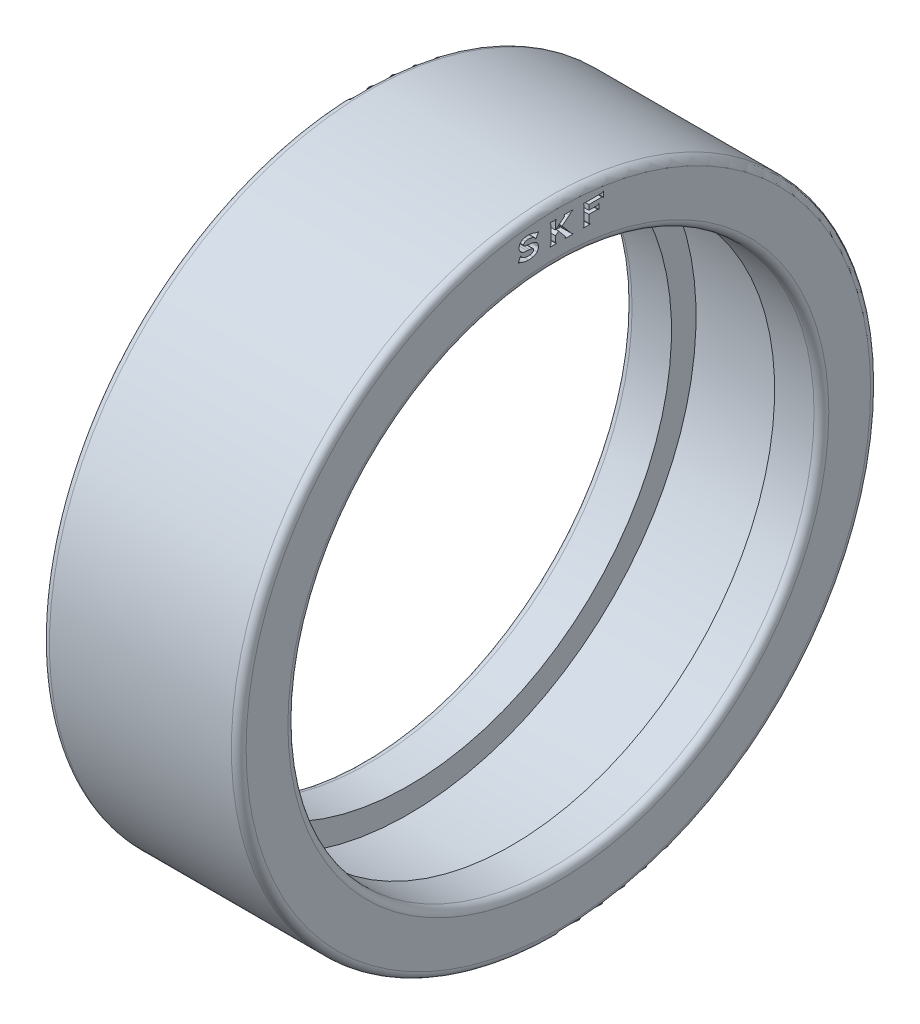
SolidWorks part; units mm, degrees
ref_plane "Plane1" through (0, 0, 0) normal (0, 0, 1) x (1, 0, 0)
ref_plane "Plane2" through (0, 0, 0) normal (0, 1, 0) x (1, 0, 0)
ref_plane "Plane3" through (0, 0, 0) normal (1, 0, 0) x (0, 0, -1)
sketch "Esquisse1" plane through (0, 0, 0) normal (0, 0, 1) x (1, 0, 0)
  line L0 (0, 13) -> (8, 13)
  line L1 (8, 13) -> (8, 10.7)
  line L2 (0, 13) -> (0, 10.7)
  line L3 (8, 10.7) -> (6.0976, 10.7)
  line L4 (0, 10.7) -> (1.9024, 10.7)
  line L5 (-1.3, 0) -> (9.3, 0) construction
  line L6 (1.9024, 10.7) -> (1.9024, 11.6993)
  line L7 (1.9024, 11.6993) -> (6.0976, 11.6993)
  line L8 (6.0976, 11.6993) -> (6.0976, 10.7)
revolve "Base-Révolution" add sketch "Esquisse1" angle 360 about L5
fillet "Congé1" radius 0.3
sketch "Esquisse2" plane through (0, 0, 0) normal (-1, 0, 0) x (0, 0, 1)
  text T0 "S K F" font "Copperplate Gothic Bold" height 1.5
  point P1 (0, 0)
extrude "Enlèv. mat.-Extru.1" cut sketch "Esquisse2" against normal blind 0.5
sketch "Esquisse3" plane through (8, 0, 0) normal (1, 0, 0) x (0, 0, -1)
  text T0 "S K F" font "Copperplate Gothic Bold" height 1.5
  point P1 (0, 0)
extrude "Enlèv. mat.-Extru.2" cut sketch "Esquisse3" against normal blind 0.5
